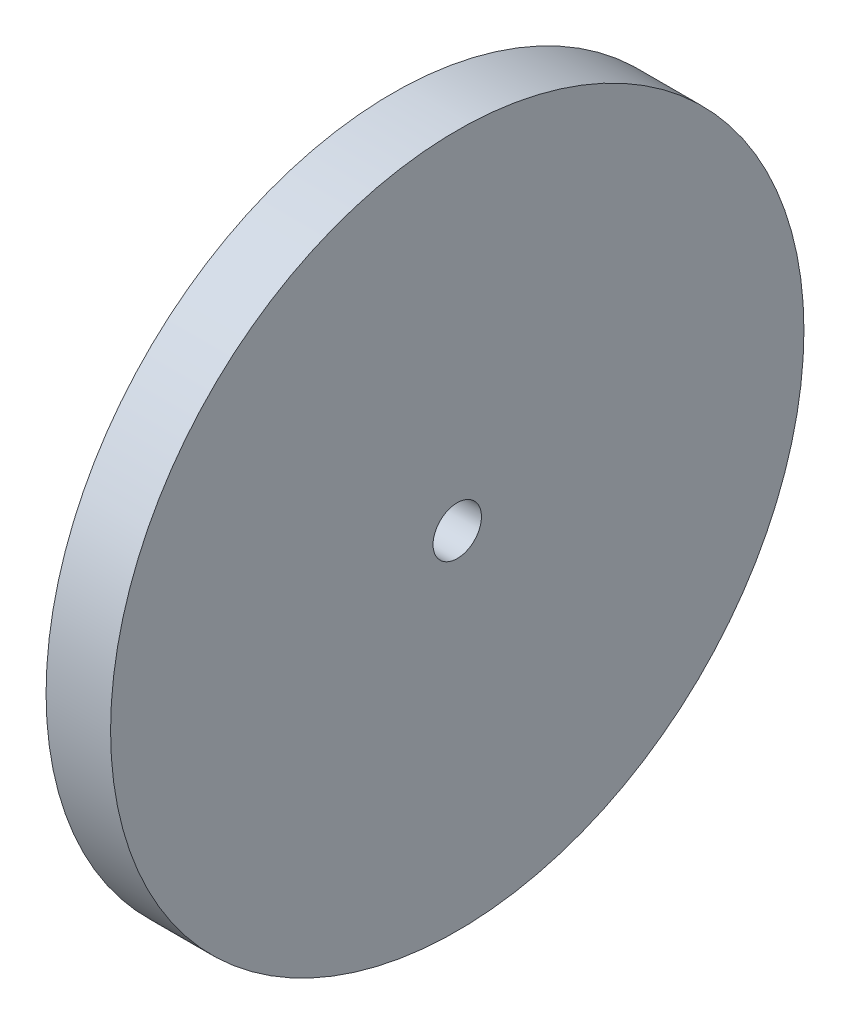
SolidWorks part; units mm, degrees
ref_plane "Plan de face" through (0, 0, 0) normal (0, 0, 1) x (1, 0, 0)
ref_plane "Plan de dessus" through (0, 0, 0) normal (0, 1, 0) x (1, 0, 0)
ref_plane "Plan de droite" through (0, 0, 0) normal (1, 0, 0) x (0, 0, -1)
sketch "Esquisse1" plane through (0, 0, 0) normal (0, 0, 1) x (1, 0, 0)
  line L0 (0, 0) -> (75.8837, 0) construction
  line L1 (0, 15) -> (40, 15)
  line L2 (0, 15) -> (0, 215)
  line L3 (0, 215) -> (40, 215)
  line L4 (40, 215) -> (40, 15)
  dimension "D1" = 30
  dimension "D2" = 200
revolve "Révolution1" add sketch "Esquisse1" angle 360 about L0
